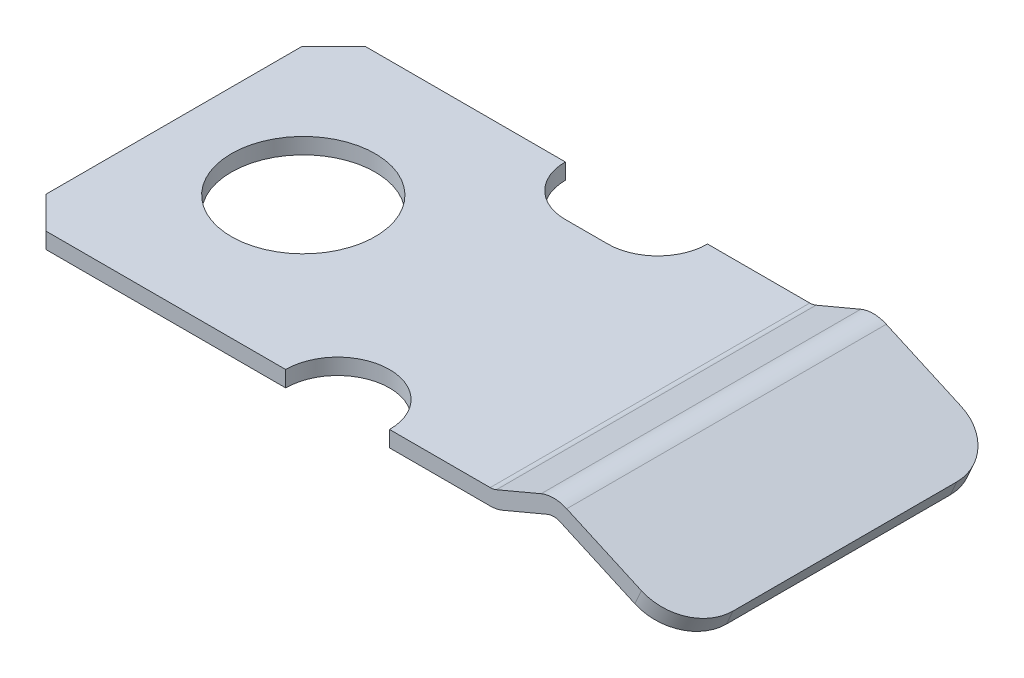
SolidWorks part; units mm, degrees
ref_plane "Plan de face" through (0, 0, 0) normal (0, 0, 1) x (1, 0, 0)
ref_plane "Plan de dessus" through (0, 0, 0) normal (0, 1, 0) x (1, 0, 0)
ref_plane "Plan de droite" through (0, 0, 0) normal (1, 0, 0) x (0, 0, -1)
sketch "Esquisse1" plane through (0, 0, 0) normal (0, 0, 1) x (1, 0, 0)
  line L0 (15.2877, 0.0787) -> (16.6883, 0.67)
  line L1 (0, 0) -> (14.8988, 0)
  line L2 (0, 0) -> (0, 0.5)
  line L3 (0, 0.5) -> (14.8988, 0.5)
  line L5 (17.0876, 0.6654) -> (20.7951, -1)
  line L6 (20.7951, -1) -> (21, -0.5439)
  line L7 (21, -0.5439) -> (17.2925, 1.1215)
  line L8 (16.4938, 1.1306) -> (15.0932, 0.5394)
  arc A0 (14.8988, 0.5) -> (15.0932, 0.5394) centre (14.8988, 1) ccw
  arc A1 (16.6883, 0.67) -> (17.0876, 0.6654) centre (16.8827, 0.2093) cw
  arc A2 (14.8988, 0) -> (15.2877, 0.0787) centre (14.8988, 1) ccw
  arc A3 (16.4938, 1.1306) -> (17.2925, 1.1215) centre (16.8827, 0.2093) cw
  point P10 (15, 0.5)
  point P18 (16.8951, 1.3)
  dimension "D9" = 0.5
  dimension "D10" = 1
  dimension "D1" = 0.5
  dimension "D2" = 0.5
  dimension "D3" = 0.5
  dimension "D4" = 21
  dimension "D5" = 15
  dimension "D6" = 1.3
  dimension "D7" = 2.3
  dimension "D8" = 4.5
extrude "Extrusion1" add sketch "Esquisse1" along normal mid plane 10
sketch "Esquisse2" plane through (0, 0.5, 0) normal (0, 1, 0) x (-1, 0, 0)
  line L0 (-14.8988, 5) -> (0, 5) construction
  line L1 (-14.8988, -5) -> (0, -5) construction
  line L2 (0, 5) -> (0, -5) construction
  line L3 (-10.14, -3.44) -> (-8.81, -3.44)
  line L4 (-11.7, -5) -> (-7.25, -5)
  line L5 (-4.05, 0) -> (0, 0) construction
  circle A0 centre (-4.05, 0) radius 2.25
  circle A1 centre (-10.125, 5) radius 1.625
  arc A2 (-10.14, -3.44) -> (-11.7, -5) centre (-10.14, -5) ccw
  arc A3 (-7.25, -5) -> (-8.81, -3.44) centre (-8.81, -5) ccw
  point P6 (-1.8, 0)
  point P13 (-8.5, 5)
  point P14 (-10.14, -3.44)
  dimension "D1" = 4.5
  dimension "D4" = 3.25
  dimension "D2" = 1.8
  dimension "D3" = 8.5
  dimension "D5" = 1.56
  dimension "D6" = 4.45
  dimension "D7" = 3.2
extrude "Enlèv. mat.-Extru.1" cut sketch "Esquisse2" against normal blind 10
chamfer "Chanfrein1" distance 1 angle 45 2 edges at (0, 0.25, -5) (0, 0.25, 5)
fillet "Congé1" radius 1.5 2 edges at (20.8976, -0.772, -5) (20.8976, -0.772, 5)
